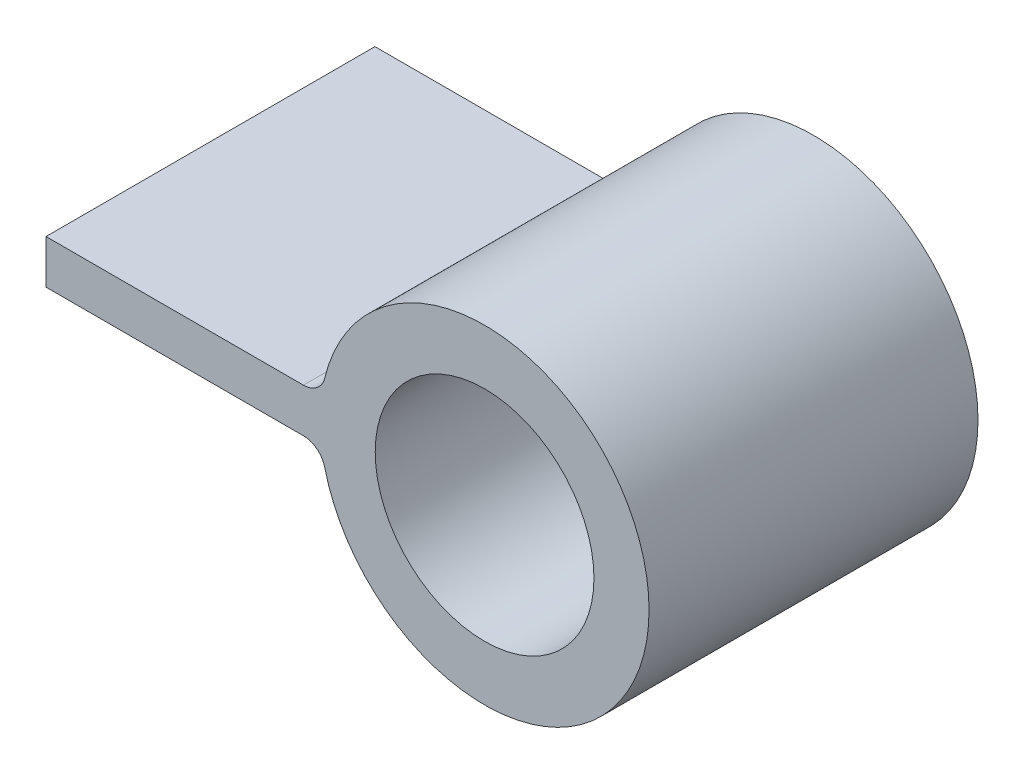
SolidWorks part; units mm, degrees
ref_plane "Front Plane" through (0, 0, 0) normal (0, 0, 1) x (1, 0, 0)
ref_plane "Top Plane" through (0, 0, 0) normal (0, 1, 0) x (1, 0, 0)
ref_plane "Right Plane" through (0, 0, 0) normal (1, 0, 0) x (0, 0, -1)
sketch "Sketch1" plane through (0, 0, 0) normal (0, 0, 1) x (1, 0, 0)
  circle A0 centre (0, 0) radius 15
  dimension "D1" = 30
extrude "Extrude1" add sketch "Sketch1" along normal blind 30
sketch "Sketch2" plane through (0, 0, 30) normal (0, 0, 1) x (1, 0, 0)
  circle A0 centre (0, 0) radius 9.975
  dimension "D1" = 19.95
extrude "Cut-Extrude1" cut sketch "Sketch2" against normal through all
sketch "Sketch3" plane through (0, 0, 0) normal (0, 0, 1) x (1, 0, 0)
  line L0 (0, 0) -> (-29.8322, 0) construction
  line L1 (0, 0) -> (0, 26.1262) construction
  line L2 (-40, -2) -> (-14.8661, -2)
  line L3 (-40, -2) -> (-40, 2)
  line L4 (-40, 2) -> (-14.8661, 2)
  circle A0 centre (0, 0) radius 15 construction
  arc A1 (-14.8661, 2) -> (-14.8661, -2) centre (0, 0) ccw
  dimension "D1" = 40
  dimension "D2" = 4
  dimension "D3" = 2
extrude "Extrude2" add sketch "Sketch3" along normal up to surface (30 mm away)
fillet "Fillet1" radius 2 2 edges at (-14.8661, -2, 15) (-14.8661, 2, 15)
